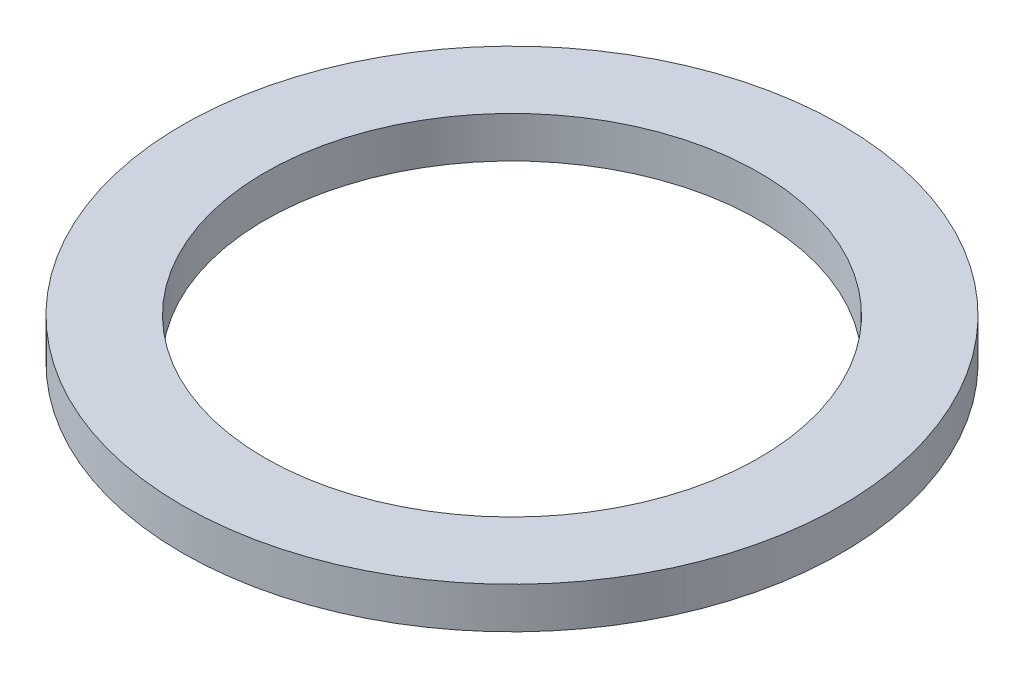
SolidWorks part; units mm, degrees
ref_plane "Plan de face" through (0, 0, 0) normal (0, 0, 1) x (1, 0, 0)
ref_plane "Plan de dessus" through (0, 0, 0) normal (0, 1, 0) x (1, 0, 0)
ref_plane "Plan de droite" through (0, 0, 0) normal (1, 0, 0) x (0, 0, -1)
sketch "Esquisse1" plane through (0, 0, 0) normal (0, 1, 0) x (1, 0, 0)
  circle A0 centre (0, 0) radius 12
  circle A1 centre (0, 0) radius 16
  dimension "D1" = 24
  dimension "D2" = 32
extrude "Extrusion1" add sketch "Esquisse1" along normal blind 2
